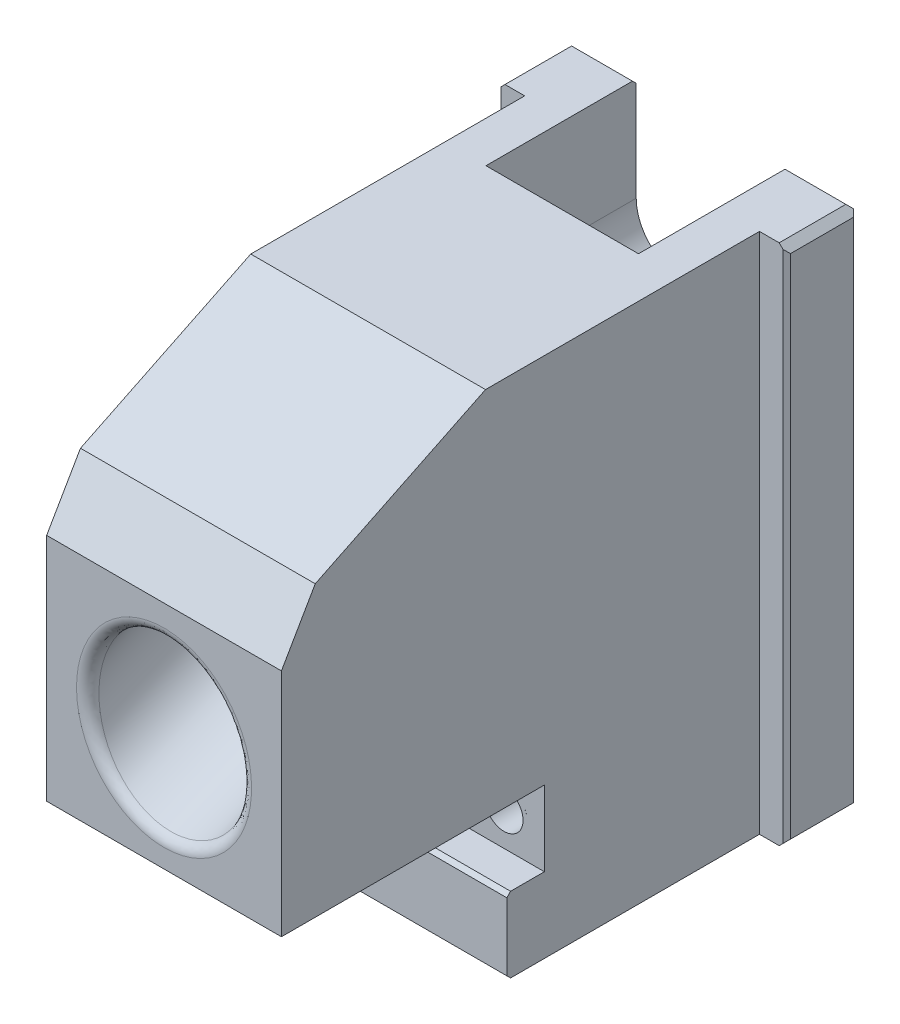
SolidWorks part; units mm, degrees
ref_plane "Front Plane" through (0, 0, 0) normal (0, 0, 1) x (1, 0, 0)
ref_plane "Top Plane" through (0, 0, 0) normal (0, 1, 0) x (1, 0, 0)
ref_plane "Right Plane" through (0, 0, 0) normal (1, 0, 0) x (0, 0, -1)
imported_body "Imported1"
sketch "Sketch1" plane through (0, 0, -37.084) normal (0, 0, -1) x (-1, 0, 0)
  line L0 (9.779, 34.798) -> (9.779, 6.2865) construction
  line L1 (9.779, 6.5405) -> (-9.779, 6.5405)
  line L2 (9.779, 6.5405) -> (9.779, 3.3655)
  line L3 (9.779, 3.3655) -> (-9.779, 3.3655)
  line L4 (-9.779, 6.5405) -> (-9.779, 3.3655)
  line L5 (-9.779, 0.508) -> (-9.779, 3.6195) construction
  line L6 (-9.525, 6.5405) -> (9.525, 6.5405) construction
  line L7 (-9.525, 3.3655) -> (9.525, 3.3655) construction
extrude "Boss-Extrude1" add sketch "Sketch1" against normal up to vertex
sketch "Sketch2" plane through (0, 3.3655, 0) normal (0, -1, 0) x (1, 0, 0)
  line L3 (9.779, -37.084) -> (9.779, -36.83)
  line L4 (9.779, -36.83) -> (9.525, -37.084)
  line L5 (9.525, -37.084) -> (9.779, -37.084)
  line L6 (9.779, -37.084) -> (9.779, -36.83)
  line L7 (9.779, -36.83) -> (9.525, -37.084)
  line L8 (9.525, -37.084) -> (9.779, -37.084)
  line L9 (-9.779, -37.084) -> (-9.525, -37.084)
  line L10 (-9.525, -37.084) -> (-9.779, -36.83)
  line L11 (-9.779, -36.83) -> (-9.779, -37.084)
  line L12 (-9.779, -37.084) -> (-9.525, -37.084)
  line L13 (-9.525, -37.084) -> (-9.779, -36.83)
  line L14 (-9.779, -36.83) -> (-9.779, -37.084)
  dimension "D1" = 0
  dimension "D2" = 0
extrude "Cut-Extrude1" cut sketch "Sketch2" against normal up to next
